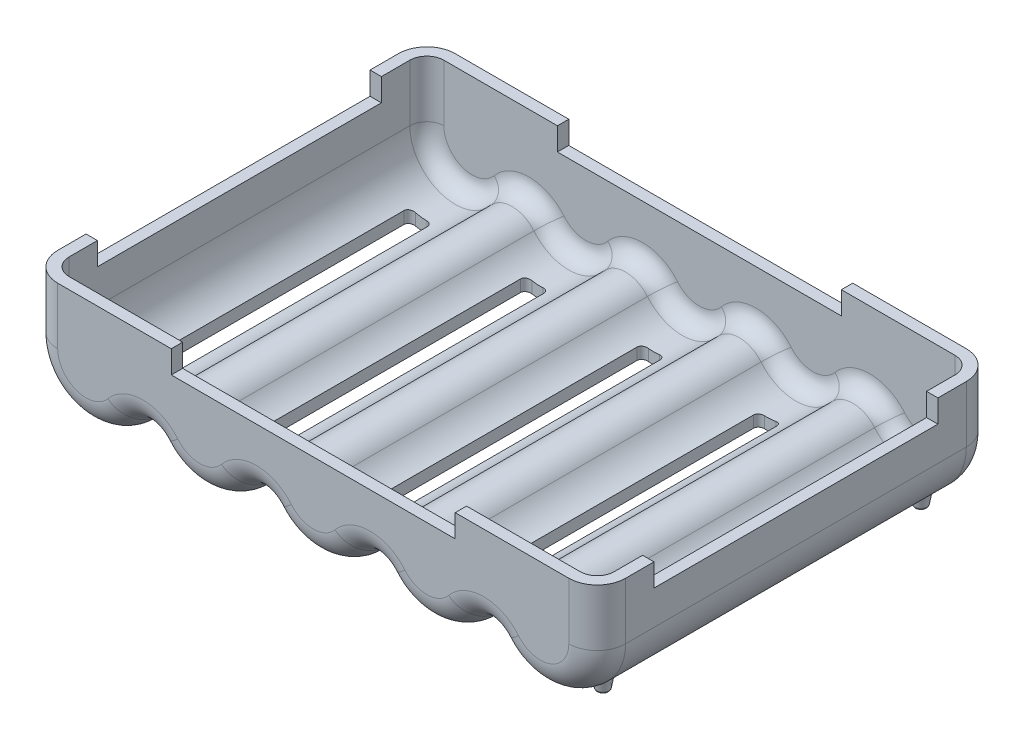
SolidWorks part; units mm, degrees
ref_plane "Front Plane" through (0, 0, 0) normal (0, 0, 1) x (1, 0, 0)
ref_plane "Top Plane" through (0, 0, 0) normal (0, 1, 0) x (1, 0, 0)
ref_plane "Right Plane" through (0, 0, 0) normal (1, 0, 0) x (0, 0, -1)
sketch "Sketch1" plane through (0, 0, 0) normal (0, 0, 1) x (1, 0, 0)
  line L0 (-25, 0) -> (25, 0)
  line L1 (-25, 0) -> (-25, -5)
  line L2 (25, -5) -> (25, 0)
  line L3 (-20, -10) -> (20, -10) construction
  arc A0 (-25, -5) -> (-16.1538, -8.1949) centre (-20, -5) ccw
  arc A1 (-13.8462, -8.1949) -> (-6.1538, -8.1949) centre (-10, -5) ccw
  arc A2 (-3.8462, -8.1949) -> (3.8462, -8.1949) centre (0, -5) ccw
  arc A3 (6.1538, -8.1949) -> (13.8462, -8.1949) centre (10, -5) ccw
  arc A4 (16.1538, -8.1949) -> (25, -5) centre (20, -5) ccw
  arc A5 (-13.8462, -8.1949) -> (-16.1538, -8.1949) centre (-15, -9.1533) ccw
  arc A6 (-3.8462, -8.1949) -> (-6.1538, -8.1949) centre (-5, -9.1533) ccw
  arc A7 (6.1538, -8.1949) -> (3.8462, -8.1949) centre (5, -9.1533) ccw
  arc A8 (16.1538, -8.1949) -> (13.8462, -8.1949) centre (15, -9.1533) ccw
  point P0 (0, 0)
  dimension "D1" = 5
  dimension "D2" = 1.5
  dimension "D3" = 50
  dimension "D4" = 10
extrude "Extrude1" add sketch "Sketch1" along normal mid plane 35
fillet "Fillet1" radius 2.5 22 edges at (21.6984, -9.7027, -17.5) (15, -7.6533, -17.5) (10, -10, -17.5) (5, -7.6533, -17.5) (0, -10, -17.5) (-5, -7.6533, -17.5) (-10, -10, -17.5) (-15, -7.6533, -17.5) (-21.6984, -9.7027, -17.5) (-25, -2.5, -17.5) (-25, -2.5, 17.5) (-21.6984, -9.7027, 17.5) (-15, -7.6533, 17.5) (-10, -10, 17.5) (-5, -7.6533, 17.5) (0, -10, 17.5) (5, -7.6533, 17.5) (10, -10, 17.5) (15, -7.6533, 17.5) (21.6984, -9.7027, 17.5) (25, -2.5, 17.5) (25, -2.5, -17.5)
shell "Shell1" thickness 1
sketch "Sketch3" plane through (0, 0, 17.5) normal (0, 0, 1) x (1, 0, 0)
  line L0 (22.5, 0) -> (-22.5, 0) construction
  line L1 (-12.5, 0) -> (12.5, 0)
  line L2 (-12.5, 0) -> (-12.5, -2)
  line L3 (-12.5, -2) -> (12.5, -2)
  line L4 (12.5, 0) -> (12.5, -2)
  point P6 (0, 0)
  dimension "D1" = 25
  dimension "D2" = 2
extrude "Extrude2" cut sketch "Sketch3" against normal through all
sketch "Sketch4" plane through (25, 0, 0) normal (1, 0, 0) x (0, 0, -1)
  line L1 (-12.5, 0) -> (12.5, 0)
  line L2 (-12.5, 0) -> (-12.5, -2)
  line L3 (-12.5, -2) -> (12.5, -2)
  line L4 (12.5, 0) -> (12.5, -2)
  point P6 (0, 0)
  dimension "D1" = 25
  dimension "D2" = 2
extrude "Extrude3" cut sketch "Sketch4" against normal through all
ref_plane "Plane1" through (0, -10, 0) normal (0, 1, 0) x (-1, 0, 0)
sketch "Sketch5" plane through (0, -10, 0) normal (0, 1, 0) x (-1, 0, 0)
  line L1 (-21.5, 12.5) -> (-19.5033, 12.5)
  line L2 (-21.5, 12.5) -> (-21.5, -12.5)
  line L3 (-21.5, -12.5) -> (-19.5033, -12.5)
  line L4 (-19.5033, 12.5) -> (-19.5033, -12.5)
  line L5 (-25, 12.5) -> (-25, -12.5) construction
  point P4 (-19.5033, 0)
  dimension "D1" = 25
  dimension "D2" = 3.5
  dimension "D3" = 1.9967
extrude "Extrude4" cut sketch "Sketch5" along normal up to next
fillet "Fillet3" radius 0.5 4 edges at (19.5033, -9.4722, -12.5) (19.5033, -9.4722, 12.5) (21.5, -9.2389, -12.5) (21.5, -9.2389, 12.5)
pattern_linear "LPattern1" count 5 spacing 10.25 along (-1, 0, 0) of "Extrude4", "Fillet3"
ref_plane "Plane2" through (0, -10.5, 0) normal (0, 1, 0) x (-1, 0, 0)
sketch "Sketch6" plane through (0, -10.5, 0) normal (0, 1, 0) x (-1, 0, 0)
  line L0 (-18.0769, 17.5) -> (-22.5, 17.5) construction
  line L1 (-25, 15) -> (-25, -15) construction
  circle A0 centre (-22, 14) radius 0.5
  dimension "D1" = 1
  dimension "D2" = 3.5
  dimension "D3" = 3
extrude "Extrude5" add sketch "Sketch6" along normal up to next draft 10
fillet "Fillet5" radius 0.25 1 edges at (22, -10.5, 14.5)
pattern_linear "LPattern6" count 2 spacing 44 along (-1, 0, 0) count 2 spacing 28 along (0, 0, -1) of "Extrude5", "Fillet5"
